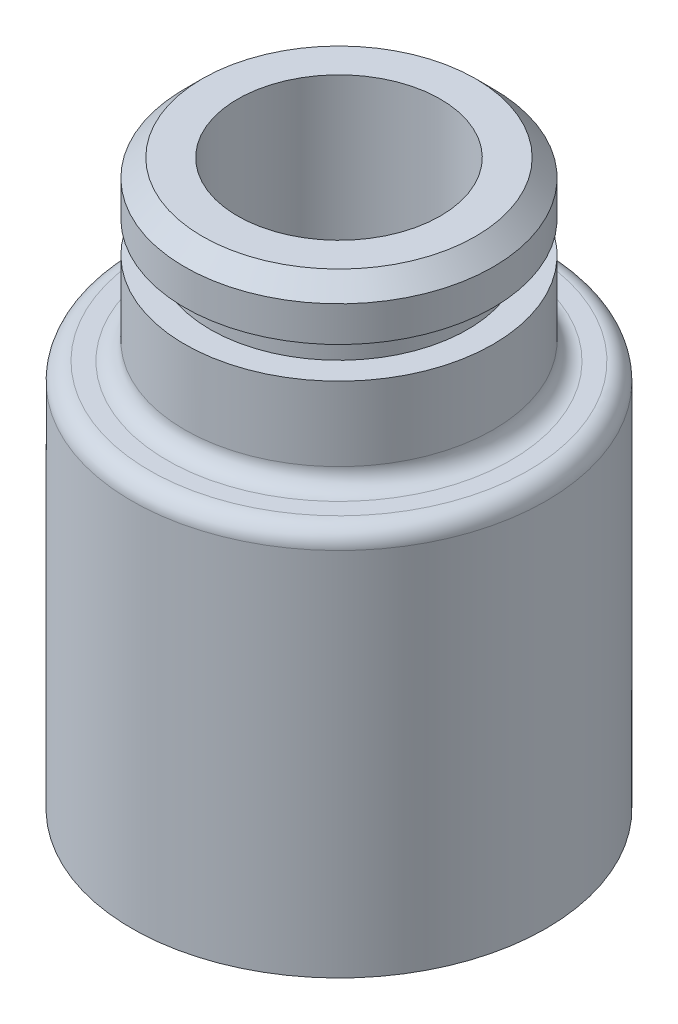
SolidWorks part; units mm, degrees
ref_plane "Front Plane" through (0, 0, 0) normal (0, 0, 1) x (1, 0, 0)
ref_plane "Top Plane" through (0, 0, 0) normal (0, 1, 0) x (1, 0, 0)
ref_plane "Right Plane" through (0, 0, 0) normal (1, 0, 0) x (0, 0, -1)
imported_body "Male-waterconnector.stp<1>"
sketch "Sketch1" plane through (0, 27.2, 0) normal (0, 1, 0) x (1, 0, 0)
  line L0 (9.75, -8.75) -> (9.75, -7.85) construction
  line L1 (9.75, -8.75) -> (9.75, -8.9) construction
  line L2 (9.75, -7.85) -> (9.75, -6.9) construction
  line L3 (2.45, 0) -> (2.85, 0) construction
  line L4 (2.45, 0) -> (1.9, 0) construction
  circle A0 centre (9.75, 0) radius 8.75 construction
  arc A1 (9.75, 8.75) -> (18.5, 0) centre (9.75, 0) ccw construction
  circle A2 centre (9.75, 0) radius 7.85 construction
  circle A3 centre (9.75, 0) radius 7.85
  circle A4 centre (9.75, 0) radius 6.9 construction
  circle A5 centre (9.75, 0) radius 8.9 construction
  circle A6 centre (9.75, 0) radius 7.3
  dimension "D1" = 0.15
  dimension "D3" = 0.4
  dimension "D2" = 2
extrude "Cut-Extrude1" cut sketch "Sketch1" along normal up to surface (1.8 mm away)
chamfer "Chamfer1" distance 1 angle 45 1 edges at (18.5, 32, 0)
